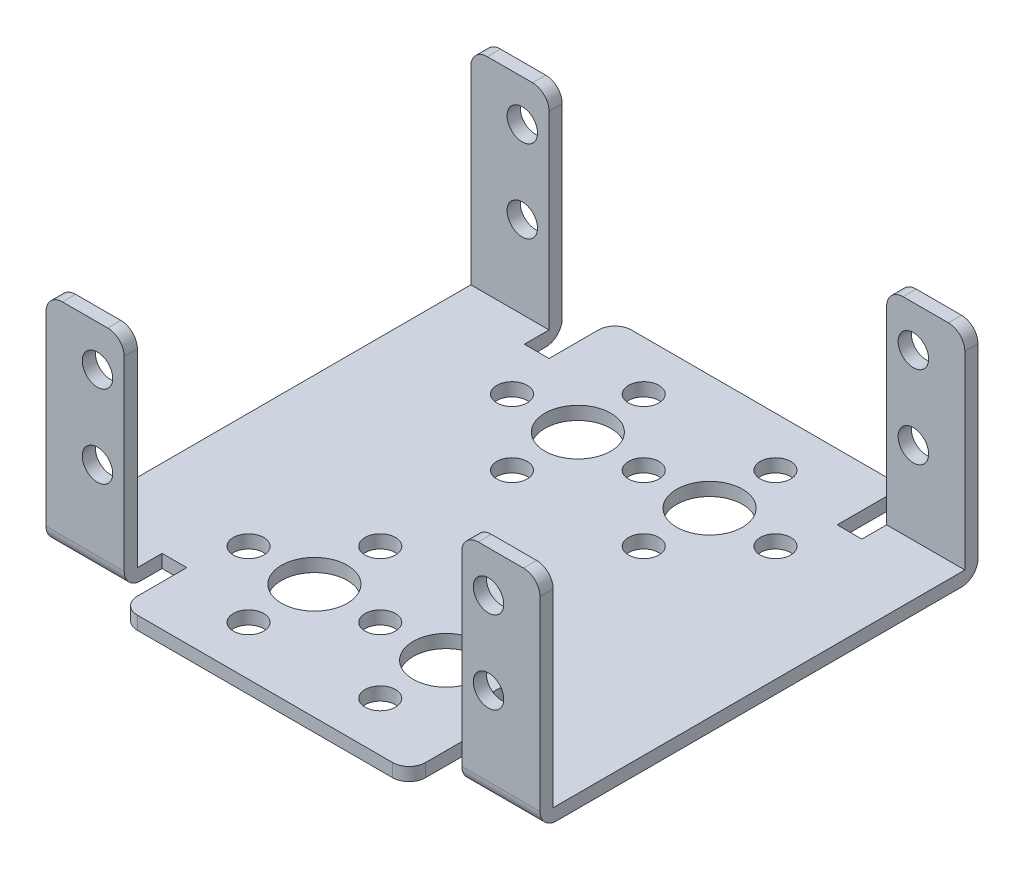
SolidWorks part; units mm, degrees
ref_plane "Front Plane" through (0, 0, 0) normal (0, 0, 1) x (1, 0, 0)
ref_plane "Top Plane" through (0, 0, 0) normal (0, 1, 0) x (1, 0, 0)
ref_plane "Right Plane" through (0, 0, 0) normal (1, 0, 0) x (0, 0, -1)
sketch "Sketch1" plane through (0, 0, 0) normal (0, 1, 0) x (1, 0, 0)
  line L0 (0, 0) -> (0, 53.2)
  line L1 (0, 53.2) -> (9.5, 53.2)
  line L2 (9.5, 53.2) -> (9.5, 48.6)
  line L3 (9.5, 48.6) -> (12.5, 48.6)
  line L4 (12.5, 48.6) -> (12.5, 56.6)
  line L5 (12.5, 56.6) -> (47.5, 56.6)
  line L6 (47.5, 56.6) -> (47.5, 48.6)
  line L7 (47.5, 48.6) -> (50.5, 48.6)
  line L8 (50.5, 48.6) -> (50.5, 53.2)
  line L9 (50.5, 53.2) -> (60, 53.2)
  line L10 (60, 53.2) -> (60, 0)
  line L11 (60, 0) -> (50.5, 0)
  line L12 (50.5, 0) -> (50.5, 4.6)
  line L13 (50.5, 4.6) -> (47.5, 4.6)
  line L14 (47.5, 4.6) -> (47.5, -3.4)
  line L15 (47.5, -3.4) -> (12.5, -3.4)
  line L16 (12.5, -3.4) -> (12.5, 4.6)
  line L17 (12.5, 4.6) -> (9.5, 4.6)
  line L18 (9.5, 4.6) -> (9.5, 0)
  line L19 (9.5, 0) -> (0, 0)
  dimension "D1" = 4.6
  dimension "D2" = 4.6
  dimension "D3" = 4.6
  dimension "D4" = 4.6
  dimension "D5" = 44
  dimension "D6" = 44
  dimension "D7" = 8
  dimension "D8" = 8
  dimension "D9" = 3
  dimension "D10" = 3
  dimension "D11" = 3
  dimension "D12" = 3
  dimension "D13" = 9.5
  dimension "D14" = 9.5
  dimension "D15" = 9.5
  dimension "D16" = 9.5
  dimension "D17" = 35
extrude "Extrude1" add sketch "Sketch1" along normal blind 1.6
sketch "Sketch4" plane through (0, 1.6, 0) normal (0, 1, 0) x (1, 0, 0)
  line L0 (0, 53.2) -> (0, 0) construction
  line L1 (0, 51.6) -> (9.5, 51.6)
  line L2 (0, 51.6) -> (0, 53.2)
  line L3 (0, 53.2) -> (9.5, 53.2)
  line L4 (9.5, 51.6) -> (9.5, 53.2)
  line L5 (60, 0) -> (60, 53.2) construction
  line L7 (60, 51.6) -> (50.5, 51.6)
  line L8 (60, 51.6) -> (60, 53.2)
  line L9 (60, 53.2) -> (50.5, 53.2)
  line L10 (50.5, 51.6) -> (50.5, 53.2)
  line L11 (60, 1.6) -> (50.5, 1.6)
  line L12 (60, 1.6) -> (60, 0)
  line L13 (60, 0) -> (50.5, 0)
  line L14 (50.5, 1.6) -> (50.5, 0)
  line L15 (0, 1.6) -> (9.5, 1.6)
  line L16 (0, 1.6) -> (0, 0)
  line L17 (0, 0) -> (9.5, 0)
  line L18 (9.5, 1.6) -> (9.5, 0)
  dimension "D1" = 1.6
  dimension "D2" = 1.6
  dimension "D3" = 1.6
  dimension "D4" = 1.6
extrude "Extrude2" add sketch "Sketch4" along normal blind 25
sketch "Sketch5" plane through (0, 0, 0) normal (0, 0, 1) x (1, 0, 0)
  line L0 (0, 0) -> (9.5, 0) construction
  line L1 (12.5, 0) -> (47.5, 0) construction
  circle A0 centre (6.25, 21.6) radius 1.85
  circle A1 centre (6.25, 11.6) radius 1.85
  circle A2 centre (53.75, 21.6) radius 1.85
  circle A3 centre (53.75, 11.6) radius 1.85
  point P6 (30, 0)
  point P9 (30, 0)
  point P12 (30, 0)
  dimension "D1" = 3.7
  dimension "D2" = 3.7
  dimension "D7" = 3.7
  dimension "D9" = 3.7
  dimension "D3" = 11.6
  dimension "D4" = 10
  dimension "D5" = 23.75
  dimension "D6" = 23.75
  dimension "D8" = 23.75
extrude "Cut-Extrude1" cut sketch "Sketch5" against normal through all
sketch "Sketch6" plane through (0, 1.6, 0) normal (0, 1, 0) x (1, 0, 0)
  line L1 (0, 51.6) -> (0, 1.6) construction
  circle A0 centre (14, 10.6) radius 1.85
  point P0 (0, 26.6)
  point P3 (0, 26.6)
  dimension "D1" = 16
  dimension "D2" = 16
  dimension "D3" = 30
  dimension "D4" = 30
  dimension "D5" = 8
  dimension "D6" = 8
sketch_block_instance "Block6-1"
sketch_block "Block6"
sketch_block_instance "Block5-1"
sketch_block "Block5"
sketch_block_instance "Block7-1"
sketch_block "Block7"
sketch_block_instance "Block7-2"
sketch_block_instance "Block7-3"
extrude "Cut-Extrude2" cut sketch "Sketch6" against normal blind 25
fillet "Fillet1" radius 2 1 edges at (60, 26.6, -0.8)
fillet "Fillet2" radius 2 3 edges at (60, 26.6, -52.4) (9.5, 26.6, -52.4) (9.5, 26.6, -0.8)
fillet "Fillet3" radius 2 1 edges at (47.5, 0.8, 3.4)
fillet "Fillet4" radius 2 5 edges at (12.5, 0.8, 3.4) (50.5, 26.6, -0.8) (0, 26.6, -0.8) (0, 26.6, -52.4) (50.5, 26.6, -52.4)
fillet "Fillet5" radius 2 1 edges at (12.5, 0.8, -56.6)
fillet "Fillet6" radius 2 1 edges at (47.5, 0.8, -56.6)
fillet "Fillet7" radius 2 2 edges at (4.75, 0, 0) (55.25, 0, 0)
fillet "Fillet8" radius 2 2 edges at (4.75, 0, -53.2) (55.25, 0, -53.2)
